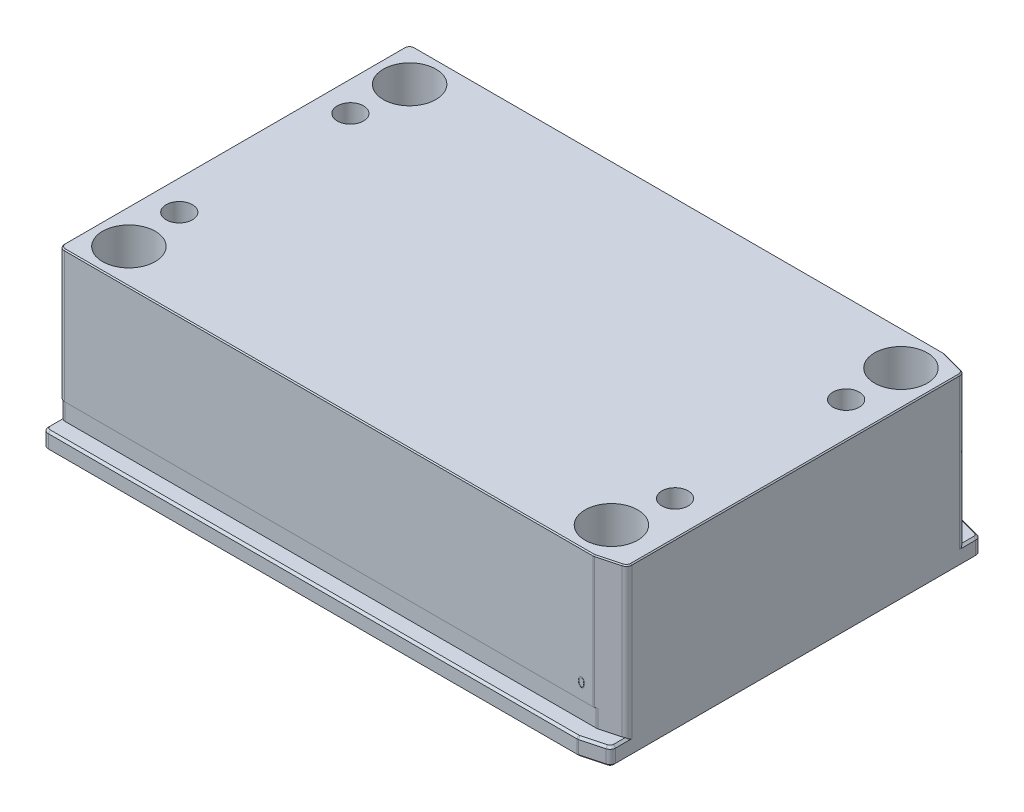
SolidWorks part; units mm, degrees
ref_plane "Front Plane" through (0, 0, 0) normal (0, 0, 1) x (1, 0, 0)
ref_plane "Top Plane" through (0, 0, 0) normal (0, 1, 0) x (1, 0, 0)
ref_plane "Right Plane" through (0, 0, 0) normal (1, 0, 0) x (0, 0, -1)
sketch "Sketch1" plane through (0, 0, 0) normal (0, 1, 0) x (1, 0, 0)
  line L0 (-101.6, -69.2912) -> (101.6, 69.2912) construction
  line L1 (-101.6, 69.2912) -> (101.6, 69.2912)
  line L2 (-101.6, 69.2912) -> (-101.6, -69.2912)
  line L3 (-101.6, -69.2912) -> (101.6, -69.2912)
  line L4 (101.6, 69.2912) -> (101.6, -69.2912)
  dimension "D1" = 203.2
  dimension "D2" = 138.5824
extrude "Boss-Extrude1" add sketch "Sketch1" along normal blind 60.325
sketch "Sketch2" plane through (101.6, 0, 0) normal (1, 0, 0) x (0, 0, -1)
  line L0 (-69.2912, 0) -> (69.2912, 0) construction
  line L1 (-69.2912, 60.325) -> (-63.4492, 60.325)
  line L2 (-69.2912, 60.325) -> (-69.2912, 6.3246)
  line L3 (-69.2912, 6.3246) -> (-63.4492, 6.3246)
  line L4 (-63.4492, 60.325) -> (-63.4492, 6.3246)
  line L5 (69.2912, 60.325) -> (63.4492, 60.325)
  line L6 (69.2912, 60.325) -> (69.2912, 6.3246)
  line L7 (69.2912, 6.3246) -> (63.4492, 6.3246)
  line L8 (63.4492, 60.325) -> (63.4492, 6.3246)
  dimension "D1" = 5.842
  dimension "D2" = 6.3246
extrude "Cut-Extrude1" cut sketch "Sketch2" against normal through all
hole_wizard "Hole1" positions "Sketch4" profile "Sketch3" legacy
sketch "Sketch4" plane through (0, 0, 0) normal (0, -1, 0) x (-1, 0, 0)
  point P0 (88.9, -50.8)
  point P2 (-85.725, -50.8)
  point P4 (-88.9, 50.8)
  point P6 (88.9, 50.8)
  dimension "D1" = 85.725
  dimension "D2" = 101.6
  dimension "D3" = 50.8
  dimension "D4" = 88.9
  dimension "D5" = 177.8
sketch "Sketch3" plane through (-88.9, 0, 50.8) normal (1, 0, 0) x (0, 0, -1)
  line L0 (0, 0) -> (0, 60.325)
  line L1 (0, 60.325) -> (9.5339, 60.325)
  line L2 (9.5339, 60.325) -> (9.5339, 7.3152)
  line L3 (9.5339, 7.3152) -> (11.049, 7.3152)
  line L4 (11.049, 7.3152) -> (11.049, 0)
  line L5 (11.049, 0) -> (0, 0)
  line L6 (0, 110) -> (0, -10) construction
  dimension "Diameter" = 19.0678
  dimension "Depth" = 60.325
  dimension "C-Bore Diameter" = 22.098
  dimension "C-Bore Depth" = 7.3152
ref_plane "Plane1" through (0, 2.54, 0) normal (0, -1, 0) x (-1, 0, 0)
hole_wizard "Hole2" positions "Sketch6" profile "Sketch5" legacy
sketch "Sketch6" plane through (0, 2.54, 0) normal (0, -1, 0) x (-1, 0, 0)
  point P0 (88.9, -50.8)
  point P2 (88.9, 50.8)
  point P4 (-88.9, 50.8)
  point P7 (-85.725, -50.8)
sketch "Sketch5" plane through (-88.9, 2.54, 50.8) normal (1, 0, 0) x (0, 0, 1)
  line L0 (0, 0) -> (0, 1.1684)
  line L1 (0, 1.1684) -> (11.684, 1.1684)
  line L2 (11.684, 1.1684) -> (11.684, 0)
  line L3 (11.684, 0) -> (0, 0)
  line L4 (0, 110) -> (0, -10) construction
  dimension "Diameter" = 23.368
  dimension "Depth" = 1.1684
chamfer "Chamfer1" distance 9.652 angle 15 4 edges at (101.6, 3.1623, -69.2912) (101.6, 33.3248, -63.4492) (101.6, 33.3248, 63.4492) (101.6, 3.1623, 69.2912)
sketch "Sketch14" plane through (101.6, 0, 0) normal (1, 0, 0) x (0, 0, -1)
  line L0 (-66.705, 6.3246) -> (-60.863, 6.3246) construction
  line L1 (-63.4492, 12.6746) -> (-63.1952, 12.6746)
  line L2 (-63.4492, 12.6746) -> (-63.4492, 6.3246)
  line L3 (-63.4492, 6.3246) -> (-63.1952, 6.3246)
  line L4 (-63.1952, 12.6746) -> (-63.1952, 6.3246)
  line L5 (63.1952, 12.6746) -> (63.4492, 12.6746)
  line L6 (63.1952, 12.6746) -> (63.1952, 6.3246)
  line L7 (63.1952, 6.3246) -> (63.4492, 6.3246)
  line L8 (63.4492, 12.6746) -> (63.4492, 6.3246)
  line L9 (-63.4492, 6.3246) -> (-63.4492, 60.325) construction
  line L10 (63.4492, 60.325) -> (63.4492, 6.3246) construction
  line L11 (60.863, 6.3246) -> (66.705, 6.3246) construction
  dimension "D1" = 0.254
  dimension "D2" = 6.35
extrude "Cut-Extrude2" cut sketch "Sketch14" against normal through all
hole_wizard "1/4-20 Tapped Hole1" positions "Sketch15" profile "Sketch16" tap size "1/4-20" standard "ANSI Inch"
sketch "Sketch15" plane through (-101.6, 0, 0) normal (-1, 0, 0) x (0, 0, 1)
  line L0 (-69.2912, 0) -> (69.2912, 0) construction
  point P0 (0, 10.16)
  dimension "D1" = 10.16
sketch "Sketch16" plane through (-101.6, 10.16, 0) normal (0, 1, 0) x (0, 0, 1)
  line L0 (0, 0) -> (0, 13.4718)
  line L1 (0, 13.4718) -> (2.5527, 11.938)
  line L2 (2.5527, 11.938) -> (2.5527, 0)
  line L5 (2.5527, 0) -> (0, 0)
  line L10 (0, 13.4718) -> (-2.5527, 11.938) construction
  line L11 (0, -6.35) -> (0, 107.95) construction
  dimension "Tap Drill Dia." = 5.1054
  dimension "Tap Drill Depth" = 11.938
  dimension "Drill Angle" = 118
hole_wizard "Hole3" positions "Sketch18" profile "Sketch17" legacy
sketch "Sketch18" plane through (0, 60.325, 0) normal (0, 1, 0) x (1, 0, 0)
  line L0 (-119.9104, 0) -> (114.473, 0) construction
  point P0 (-90.5002, -30.9626)
  point P2 (-90.5002, 30.9626)
  point P4 (88.9, 30.9626)
  point P6 (88.9, -30.9626)
  dimension "D1" = 30.9626
  dimension "D2" = 88.9
  dimension "D3" = 90.5002
sketch "Sketch17" plane through (-90.5002, 60.325, 30.9626) normal (1, 0, 0) x (0, 0, 1)
  line L0 (0, 0) -> (0, 60.325)
  line L1 (0, 60.325) -> (4.7625, 60.325)
  line L2 (4.7625, 60.325) -> (4.7625, 0)
  line L3 (4.7625, 0) -> (0, 0)
  line L4 (0, 110) -> (0, -10) construction
  dimension "Diameter" = 9.525
  dimension "Depth" = 60.325
hole_wizard "Hole4" positions "Sketch20" profile "Sketch19" legacy
sketch "Sketch20" plane through (0, 0, 0) normal (0, -1, 0) x (-1, 0, 0)
  point P0 (85.725, 0)
  point P2 (-76.2, 0)
  dimension "D1" = 76.2
  dimension "D2" = 85.725
sketch "Sketch19" plane through (-85.725, 0, 0) normal (1, 0, 0) x (0, 0, -1)
  line L0 (0, 0) -> (0, 5.1562)
  line L1 (0, 5.1562) -> (6.3627, 5.1562)
  line L2 (6.3627, 5.1562) -> (6.3627, 0)
  line L3 (6.3627, 0) -> (0, 0)
  line L4 (0, 110) -> (0, -10) construction
  dimension "Diameter" = 12.7254
  dimension "Depth" = 5.1562
hole_wizard "3/8-16 Tapped Hole1" positions "Sketch22" profile "Sketch21" tap size "3/8-16" standard "ANSI Inch"
sketch "Sketch22" plane through (0, 5.1562, 0) normal (0, -1, 0) x (-1, 0, 0)
  point P1 (-76.2, 0)
  point P4 (85.725, 0)
sketch "Sketch21" plane through (76.2, 5.1562, 0) normal (1, 0, 0) x (0, 0, -1)
  line L0 (0, 0) -> (0, 23.2889)
  line L1 (0, 23.2889) -> (3.9687, 20.9042)
  line L2 (3.9687, 20.9042) -> (3.9687, 0)
  line L5 (3.9687, 0) -> (0, 0)
  line L10 (0, 23.2889) -> (-3.9688, 20.9042) construction
  line L11 (0, -6.35) -> (0, 107.95) construction
  dimension "Tap Drill Dia." = 7.9375
  dimension "Tap Drill Depth" = 20.9042
  dimension "Drill Angle" = 118
fillet "Fillet1" radius 2.032 12 edges at (-101.6, 3.1623, 69.2912) (-101.6, 9.4996, 63.1952) (-101.6, 9.4996, -63.1952) (-101.6, 3.1623, -69.2912) (91.948, 3.1623, -69.2912) (92.8959, 9.4996, -63.1952) (101.6, 3.1623, -66.705) (101.6, 33.3248, -60.863) (101.6, 33.3248, 60.863) (92.8959, 9.4996, 63.1952) (101.6, 3.1623, 66.705) (91.948, 3.1623, 69.2912)
fillet "Fillet2" radius 2.032 4 edges at (-101.6, 36.4998, -63.4492) (91.948, 36.4998, -63.4492) (91.948, 36.4998, 63.4492) (-101.6, 36.4998, 63.4492)
chamfer "Chamfer5" distance 0.762 angle 45 1 edges at (-101.6, 10.16, 2.5527)
chamfer "Chamfer2" distance 0.381 angle 45 12 edges at (101.6, 60.325, 0) (-3.9438, 60.325, -63.4492) (-101.6, 60.325, 0) (-3.9438, 60.325, 63.4492) (96.1502, 60.325, -62.3232) (91.9457, 60.325, -63.4318) (101.1801, 60.325, -60.5407) (-101.0048, 60.325, -62.854) (101.1801, 60.325, 60.5407) (96.1502, 60.325, 62.3232) (-101.0048, 60.325, 62.854) (91.9457, 60.325, 63.4318)
chamfer "Chamfer3" distance 0.762 angle 45 26 edges at (-101.6, 6.3246, -64.2112) (-3.9438, 6.3246, -69.2912) (101.6, 6.3246, -62.2247) (101.6, 0, 0) (-3.9438, 0, -69.2912) (-101.6, 0, 0) (-3.9438, 0, 69.2912) (-101.6, 6.3246, 64.2112) (-3.9438, 6.3246, 69.2912) (101.6, 6.3246, 62.2247) (-101.0048, 6.3246, -68.696) (91.9457, 6.3246, -69.2738) (96.1502, 6.3246, -68.1652) (101.1801, 6.3246, -66.3827) (96.1502, 0, -68.1652) (91.9457, 0, -69.2738) (101.1801, 0, -66.3827) (-101.0048, 0, -68.696) (101.1801, 0, 66.3827) (96.1502, 0, 68.1652) (-101.0048, 0, 68.696) (91.9457, 0, 69.2738) (-101.0048, 6.3246, 68.696) (91.9457, 6.3246, 69.2738) (96.1502, 6.3246, 68.1652) (101.1801, 6.3246, 66.3827)
chamfer "Chamfer4" distance 0.381 angle 45 4 edges at (85.725, 7.3152, 41.2661) (88.9, 7.3152, -60.3339) (-88.9, 7.3152, -60.3339) (-88.9, 7.3152, 41.2661)
sketch "Sketch23" plane through (0, 0, 63.4492) normal (0, 0, 1) x (1, 0, 0)
  text T0 "0"
extrude "Cut-Extrude3" cut sketch "Sketch23" against normal blind 0.0508
